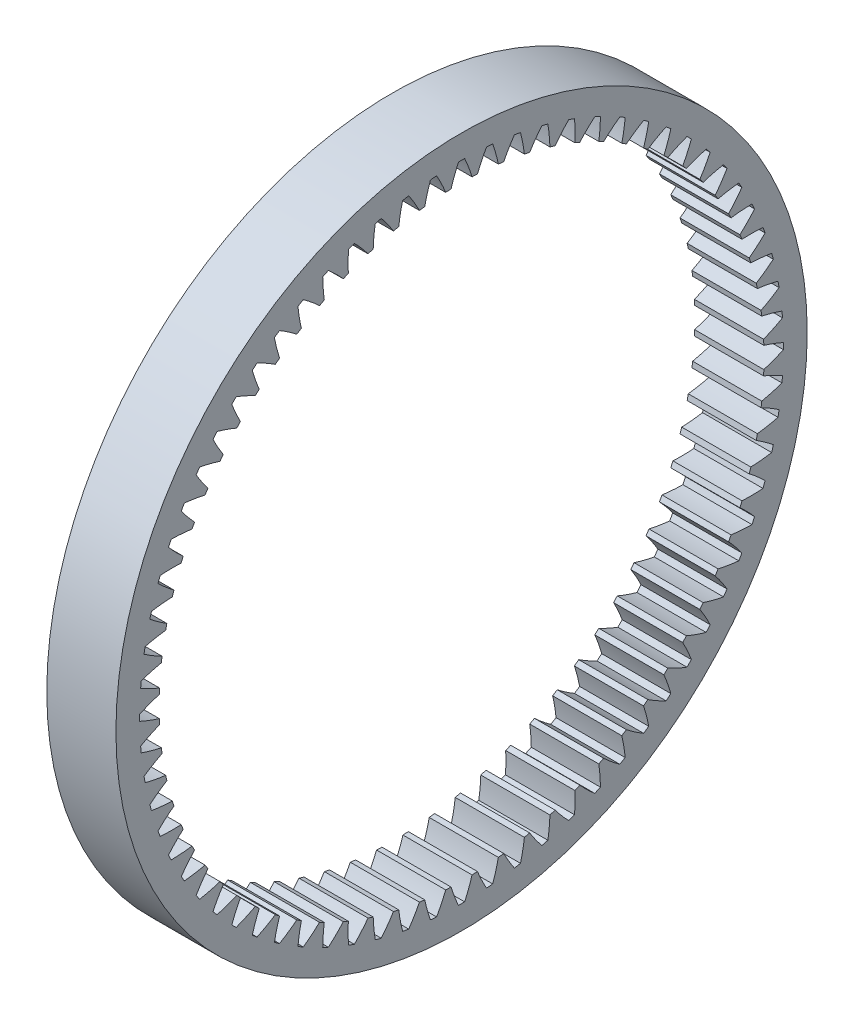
SolidWorks part; units mm, degrees
ref_plane "Plane1" through (0, 0, 0) normal (0, 0, 1) x (1, 0, 0)
ref_plane "Plane2" through (0, 0, 0) normal (0, 1, 0) x (1, 0, 0)
ref_plane "Plane3" through (0, 0, 0) normal (1, 0, 0) x (0, 0, -1)
revolve "Base-Revolve" add sketch "BasProSke" angle 360 about L0
sketch "BasProSke" plane through (0, 0, 0) normal (0, 1, 0) x (1, 0, 0)
  line L0 (-10, 0) -> (60, 0) construction
  line L1 (0, 222.25) -> (0, 254)
  line L2 (0, 222.25) -> (50.8, 222.25)
  line L3 (50.8, 222.25) -> (50.8, 254)
  line L4 (50.8, 254) -> (0, 254)
  dimension "Diameter" = 508
  dimension "Thickness" = 50.8
  dimension "Inside_diameter" = 444.5
sketch "HoldingSke" plane through (0, 0, 0) normal (0, 1, 0) x (1, 0, 0)
  line L0 (0, 0) -> (31.3961, -96.6273)
  line L1 (-15, 0) -> (100, 0) construction
  line L2 (0, 0) -> (-2.1039, 2.3779)
  line L3 (0, 0) -> (-11.863, 4.5341)
  line L4 (0, 0) -> (2.6687, 8.2133)
  line L5 (0, 0) -> (-23.7986, -8.8762)
  line L6 (0, 0) -> (-10.5278, -7.1032)
  line L7 (-2.1039, 2.3779) -> (3.3635, 27.1825)
  line L8 (-76.2, 54.61) -> (-54.61, 54.61)
  line L9 (-71.009, 38.7566) -> (-53.1078, 45.2721)
  line L10 (-76.2, 71.12) -> (104.1128, 71.12)
  line L11 (0, 0) -> (-50.8, 0)
  line L12 (-76.2, 101.6) -> (-75.9714, 101.6)
  line L13 (24.9733, 27.94) -> (52.9518, 28.4284)
  line L14 (24.9733, 27.94) -> (24.9746, 27.94)
  line L15 (24.9733, 27.94) -> (100.4006, 29.5858)
  circle A0 centre (0, 0) radius 254
  circle A1 centre (0, 0) radius 12.7
  circle A2 centre (0, 0) radius 12.7
  dimension "MHD" = 25.4
  dimension "Hub_dia" = 25.4
  dimension "Diameter" = 508
  dimension "Num_teeth" = 72
  dimension "Pitch_radius" = 180.3128
  dimension "Pitch" = 101.6
  dimension "Width" = 50.8
  dimension "Overall_len" = 25.4
  dimension "Show_teeth" = 72
  dimension "Thickness" = 12.7
  dimension "OAL" = 25.4001
  dimension "T_dim" = 21.59
  dimension "Ap" = 20
  dimension "H" = 19.05
  dimension "Backlash" = 0.2286
  dimension "Addendum_fac" = 1
  dimension "Dedendum_fac" = 1.25
  dimension "Clearance_fac" = 0.25
  dimension "Dedendum_add" = 0.0013
sketch "TooCutSke" plane through (0, 0, 0) normal (1, 0, 0) x (0, 0, -1)
  line L3 (5.5584, 228.5324) -> (5.5584, 53.6633) construction
  line L4 (0, 0) -> (0, 59.563) construction
  line L5 (0, 0) -> (-2.9804, 68.2625) construction
  line L6 (-101.7153, 189.0756) -> (29.3737, 194.799) construction
  circle A0 centre (0, 0) radius 228.6 construction
  circle A1 centre (0, 0) radius 236.5388 construction
  circle A2 centre (0, 0) radius 193.3324 construction
  circle A3 centre (0, 0) radius 222.2246 construction
  arc A4 (7.7127, 222.0907) -> (2.2691, 236.5279) centre (-101.7153, 189.0756) ccw
  arc A5 (7.7127, 222.0907) -> (-7.7127, 222.0907) centre (0, 0) ccw
  arc A6 (2.2691, 236.5279) -> (-2.2691, 236.5279) centre (0, 0) ccw
  arc A7 (-2.2691, 236.5279) -> (-7.7127, 222.0907) centre (101.7153, 189.0756) ccw
  dimension "Pitch_dia" = 457.2
  dimension "Base_dia" = 386.6647
  dimension "Root_dia" = 473.0775
  dimension "Overcut_dia" = 444.4492
  dimension "Flank_rad" = 114.3
  dimension "Half_ang" = 2.5
  dimension "Half_CT" = 5.5584
extrude "ToothCut" cut sketch "TooCutSke" along normal through all
fillet "Breaks" radius 0.635
fillet "RootFillets" radius 1.5888
pattern_circular "TeethCuts" count 72 every 5 about axis through (-10, 0, 0) along (1, 0, 0) of "RootFillets", "Breaks", "ToothCut"
equation "' \"Pitch@HoldingSke\" = 4"
equation "' \"Num_teeth@HoldingSke\" = 24"
equation "' \"Ap@HoldingSke\" =  14.5"
equation "' \"Width@HoldingSke\" = 0.5"
equation "' \"Diameter@HoldingSke\" = 8"
equation "' \"Show_teeth@HoldingSke\" = 100"
equation "' \"Backlash@HoldingSke\" = 0.009"
equation "' \"Addendum_fac@HoldingSke\" = 1.0"
equation "' \"Dedendum_fac@HoldingSke\" = 1.25"
equation "' \"Dedendum_add@HoldingSke\" = 0.00005"
equation "' \"Clearance_fac@HoldingSke\" = 0.25"
equation "\"Overcut_dia@TooCutSke\" = (\"Num_teeth@HoldingSke\" - 2 * \"Addendum_fac@HoldingSke\") / \"Pitch@HoldingSke\" - 0.002"
equation "\"Pitch_dia@TooCutSke\" = \"Num_teeth@HoldingSke\" / \"Pitch@HoldingSke\""
equation "\"Base_dia@TooCutSke\" = \"Num_teeth@HoldingSke\" / \"Pitch@HoldingSke\" * cos((\"Ap@HoldingSke\"  * 3.14159265 / 180)) * 0.90"
equation "\"Root_dia@TooCutSke\" = \"Num_teeth@HoldingSke\"  / \"Pitch@HoldingSke\" + 2 *  \"Dedendum_fac@HoldingSke\"/ \"Pitch@HoldingSke\" + \"Dedendum_add@HoldingSke\" * 2"
equation "\"Half_ang@TooCutSke\" = 180 / \"Num_teeth@HoldingSke\""
equation "\"Half_CT@TooCutSke\" = \"Num_teeth@HoldingSke\" / \"Pitch@HoldingSke\" * sin((3.14159265 / 2 / \"Num_teeth@HoldingSke\")) / 2 + 10 * \"Backlash@HoldingSke\" / 4"
equation "\"Flank_rad@TooCutSke\" = \"Num_teeth@HoldingSke\" / \"Pitch@HoldingSke\" / 4"
equation "\"Radius@RootFillets\"= \"Clearance_fac@HoldingSke\" / \"Pitch@HoldingSke\" + \"Dedendum_add@HoldingSke\""
equation "\"Break_rad@Breaks\" = 0.02 / \"Pitch@HoldingSke\" * 5"
equation "\"Num_teeth@TeethCuts\" = int( \"Show_teeth@HoldingSke\" ) + 1"
equation "\"Num_teeth@TeethCuts\" = ((sgn( \"Num_teeth@TeethCuts\" - \"Num_teeth@HoldingSke\" )-1)*( \"Num_teeth@TeethCuts\" - \"Num_teeth@HoldingSke\" ))/-2+ \"Num_teeth@HoldingSke\""
equation "\"Num_teeth@TeethCuts\" = ((sgn( \"Num_teeth@TeethCuts\" - 2.0)+1)*( \"Num_teeth@TeethCuts\" - 2.0))/2 +2.0"
equation "\"Angle@TeethCuts\" = 360.0 / \"Num_teeth@HoldingSke\""
equation "\"Diameter@BasProSke\" = \"Num_teeth@HoldingSke\"  / \"Pitch@HoldingSke\" + 2 *  \"Dedendum_fac@HoldingSke\"/ \"Pitch@HoldingSke\" + \"Dedendum_add@HoldingSke\" * 2 + 0.002"
equation "\"Diameter@BasProSke\" = ((sgn( \"Diameter@BasProSke\"  - \"Diameter@HoldingSke\" )+1)*( \"Diameter@BasProSke\"  - \"Diameter@HoldingSke\" ))/2 + \"Diameter@HoldingSke\""
equation "\"Inside_diameter@BasProSke\" =  (\"Num_teeth@HoldingSke\" - 2 * \"Addendum_fac@HoldingSke\") / \"Pitch@HoldingSke\" "
equation "\"Thickness@BasProSke\"  = \"Width@HoldingSke\""
